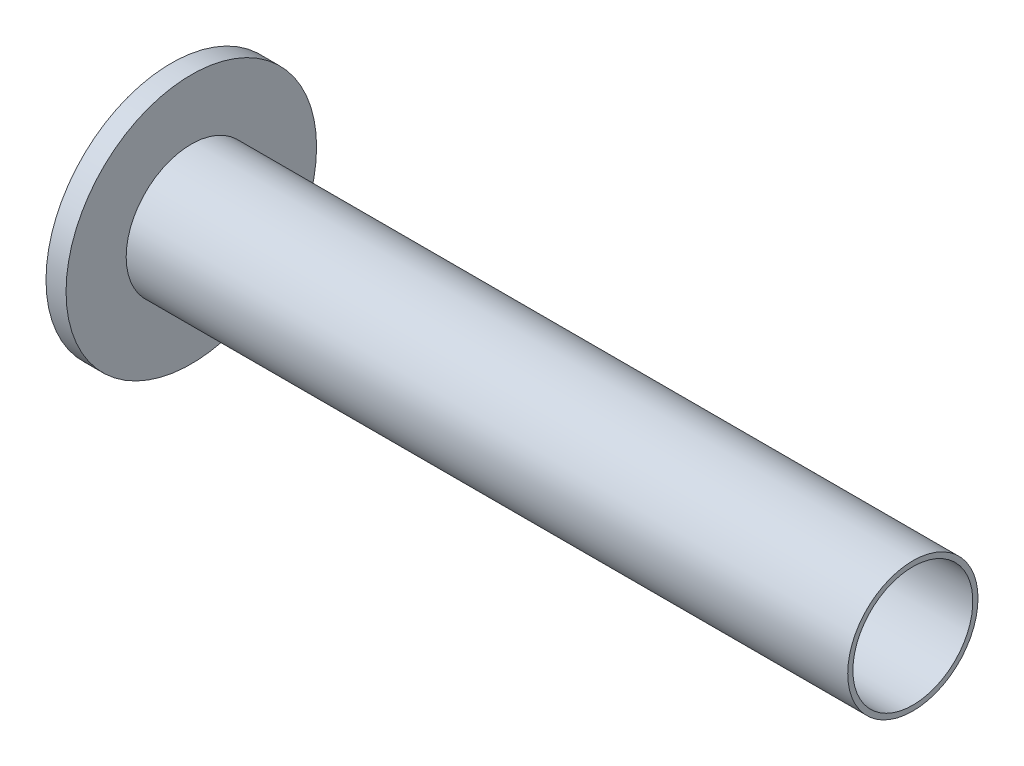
SolidWorks part; units mm, degrees
ref_plane "Front Plane" through (0, 0, 0) normal (0, 0, 1) x (1, 0, 0)
ref_plane "Top Plane" through (0, 0, 0) normal (0, 1, 0) x (1, 0, 0)
ref_plane "Right Plane" through (0, 0, 0) normal (1, 0, 0) x (0, 0, -1)
sketch "Sketch1" plane through (0, 0, 0) normal (1, 0, 0) x (0, 0, -1)
  circle A0 centre (0, 0) radius 20.6375
  dimension "D1" = 41.275
extrude "Extrude1" add sketch "Sketch1" along normal blind 228.6
sketch "Sketch2" plane through (0, 0, 0) normal (-1, 0, 0) x (0, 0, 1)
  circle A0 centre (0, 0) radius 39.6875
  dimension "D1" = 79.375
extrude "Extrude2" add sketch "Sketch2" along normal blind 6.35
sketch "Sketch3" plane through (-6.35, 0, 0) normal (-1, 0, 0) x (0, 0, 1)
  circle A0 centre (0, 0) radius 18.9992
  dimension "D1" = 37.9984
extrude "Cut-Extrude1" cut sketch "Sketch3" against normal through all
